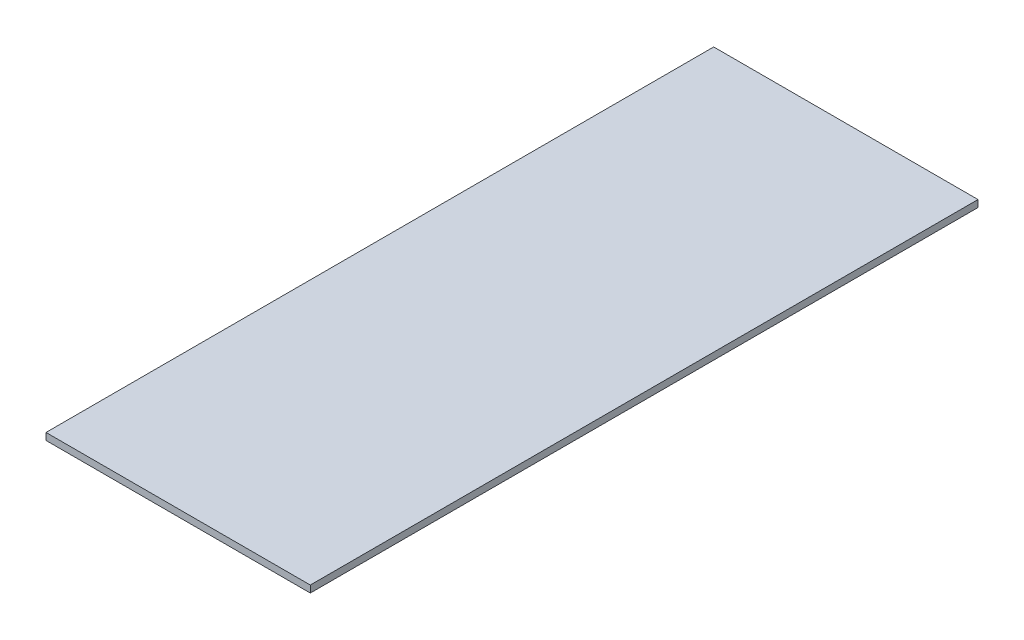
SolidWorks part; units mm, degrees
ref_plane "Front Plane" through (0, 0, 0) normal (0, 0, 1) x (1, 0, 0)
ref_plane "Top Plane" through (0, 0, 0) normal (0, 1, 0) x (1, 0, 0)
ref_plane "Right Plane" through (0, 0, 0) normal (1, 0, 0) x (0, 0, -1)
sketch "Sketch1" plane through (0, 0, 0) normal (0, 1, 0) x (1, 0, 0)
  line L1 (0, 0) -> (180.975, 0)
  line L2 (0, 0) -> (0, 457.2)
  line L3 (0, 457.2) -> (180.975, 457.2)
  line L4 (180.975, 0) -> (180.975, 457.2)
  dimension "D1" = 180.975
  dimension "D2" = 457.2
extrude "Boss-Extrude1" add sketch "Sketch1" along normal blind 4.7625
sketch "Sketch2" plane through (0, 0, 0) normal (0, 0, 1) x (1, 0, 0)
  line L0 (0, 4.7625) -> (180.975, 4.7625) construction
  line L1 (2.54, 4.445) -> (7.62, 4.445)
  line L2 (2.54, 4.445) -> (2.54, 0.3175)
  line L3 (2.54, 0.3175) -> (7.62, 0.3175)
  line L4 (7.62, 4.445) -> (7.62, 0.3175)
  line L5 (0, 0) -> (180.975, 0) construction
  line L8 (0, 4.7625) -> (0, 0) construction
  dimension "D1" = 0.3175
  dimension "D2" = 0.3175
  dimension "D3" = 2.54
  dimension "D4" = 5.08
extrude "Cut-Extrude3" [suppressed] cut sketch "Sketch2" against normal through all
pattern_linear "LPattern1" [suppressed] count 33 spacing 5.3975 count 2 spacing 5.3975
